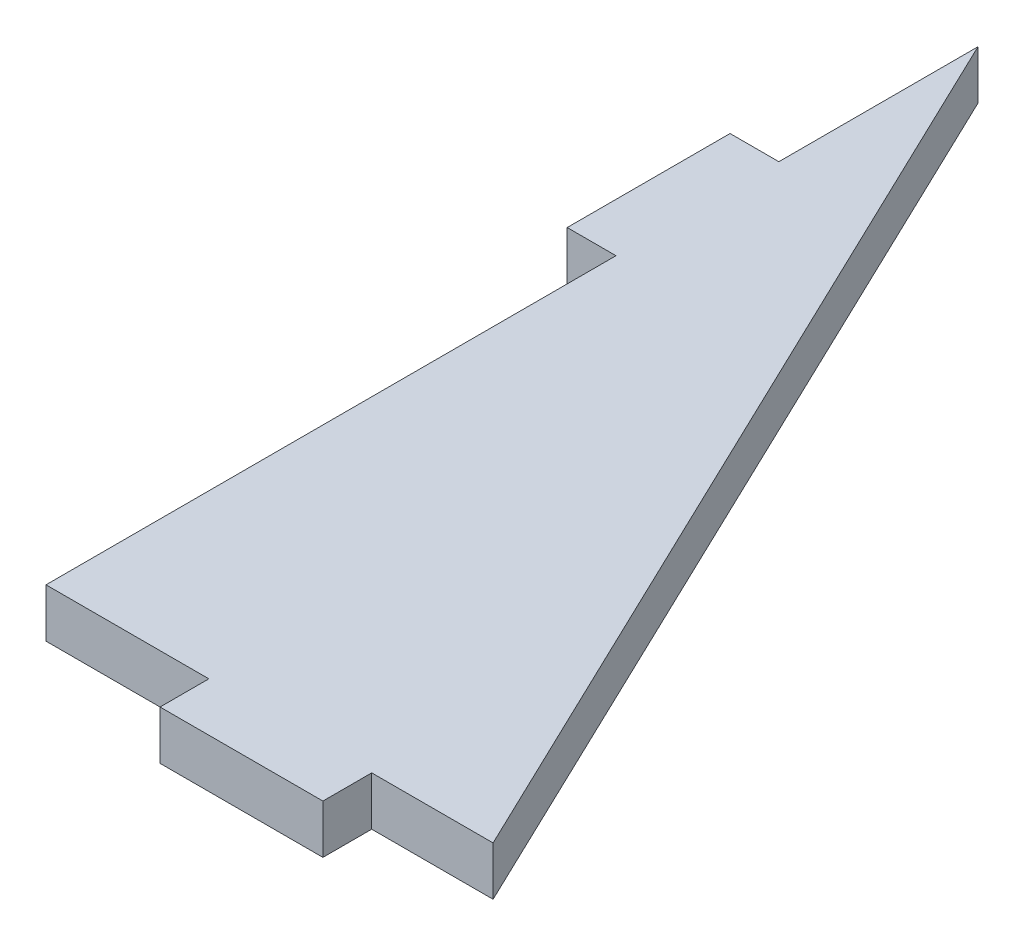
SolidWorks part; units mm, degrees
ref_plane "Front Plane" through (0, 0, 0) normal (0, 0, 1) x (1, 0, 0)
ref_plane "Top Plane" through (0, 0, 0) normal (0, 1, 0) x (1, 0, 0)
ref_plane "Right Plane" through (0, 0, 0) normal (1, 0, 0) x (0, 0, -1)
sketch "Sketch1" plane through (0, 0, 0) normal (0, 1, 0) x (1, 0, 0)
  line L0 (0, 0) -> (0, 57.2276)
  line L1 (0, 57.2276) -> (27.4519, 0)
  line L2 (27.4519, 0) -> (0, 0)
  line L4 (0, 45) -> (-2.9972, 45)
  line L5 (0, 45) -> (0, 35)
  line L6 (0, 35) -> (-2.9972, 35)
  line L7 (-2.9972, 45) -> (-2.9972, 35)
  line L8 (-1.4986, 35) -> (-1.4986, 45) construction
  line L9 (0, 40) -> (-2.9972, 40) construction
  line L10 (20, 0) -> (10, 0)
  line L11 (20, 0) -> (20, -2.9972)
  line L12 (20, -2.9972) -> (10, -2.9972)
  line L13 (10, 0) -> (10, -2.9972)
  line L14 (15, -2.9972) -> (15, 0) construction
  line L15 (20, -1.4986) -> (10, -1.4986) construction
  point P12 (25.2632, 0)
  point P13 (0, 54.0537)
  point P14 (0, 57.2276)
  point P15 (27.4519, 0)
  point P152 (15, -1.4986)
  point P236 (-1.4986, 40)
  dimension "D1" = 2.9972
  dimension "D2" = 2.9972
  dimension "D3" = 15
  dimension "D4" = 40
  dimension "D5" = 10
  dimension "D6" = 10
extrude "Boss-Extrude1" add sketch "Sketch1" along normal blind 2.9972 contours L2 L1 L0 | L2 L13 L12 L11 | L7 L6 L5 L4
